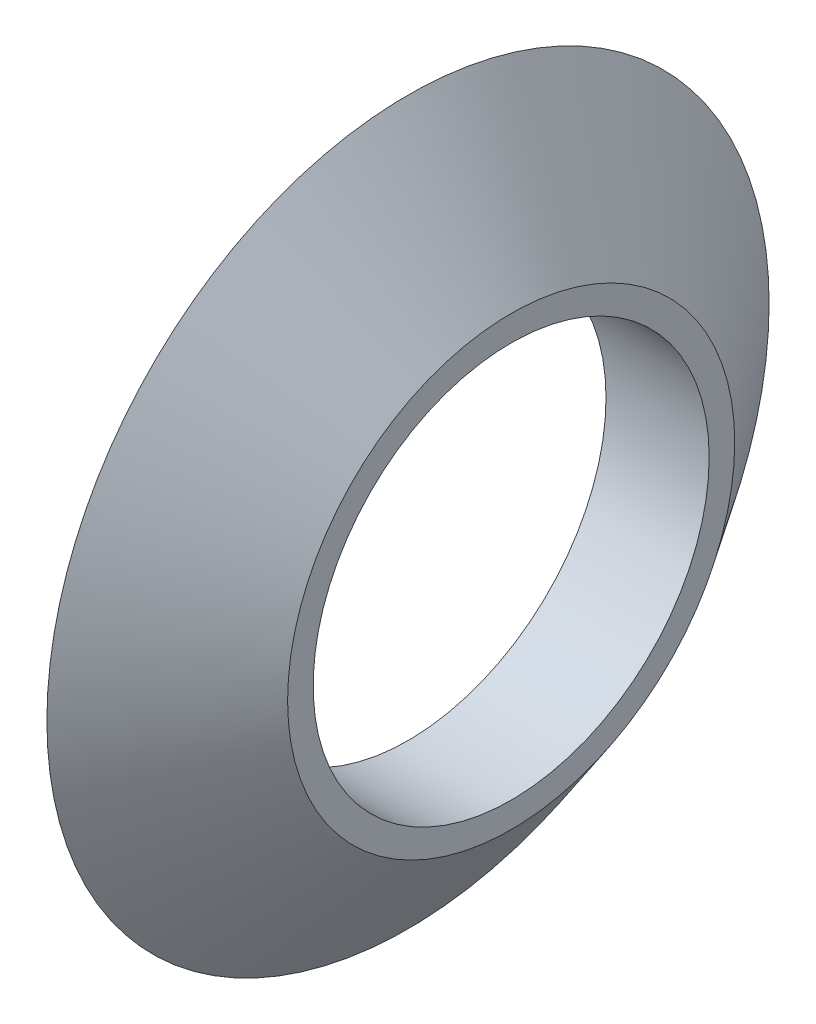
SolidWorks part; units mm, degrees
ref_plane "Face" through (0, 0, 0) normal (0, 0, 1) x (1, 0, 0)
ref_plane "Dessus" through (0, 0, 0) normal (0, 1, 0) x (1, 0, 0)
ref_plane "Droite" through (0, 0, 0) normal (1, 0, 0) x (0, 0, -1)
sketch "Esquisse1" plane through (0, 0, 0) normal (0, 0, 1) x (1, 0, 0)
  line L0 (0, 0) -> (-9.0297, 0) construction
  line L1 (0, 17.8049) -> (0, -12.7178) construction
  line L2 (-8.4596, 11.2794) -> (0, 0) construction
  line L3 (-4.24, 5.6533) -> (-2.625, 3.5)
  line L4 (-4.24, 5.6533) -> (-4.24, 3.1)
  line L5 (-4.24, 3.1) -> (-2.625, 3.1)
  line L6 (-2.625, 3.5) -> (-2.625, 3.1)
  point P3 (-5.625, 7.5)
  dimension "D1" = 15
  dimension "D2" = 11.25
  dimension "D3" = 6.2
  dimension "D4" = 4.24
  dimension "D5" = 5.25
revolve "Base-Révolution" add sketch "Esquisse1" angle 360 about L0
